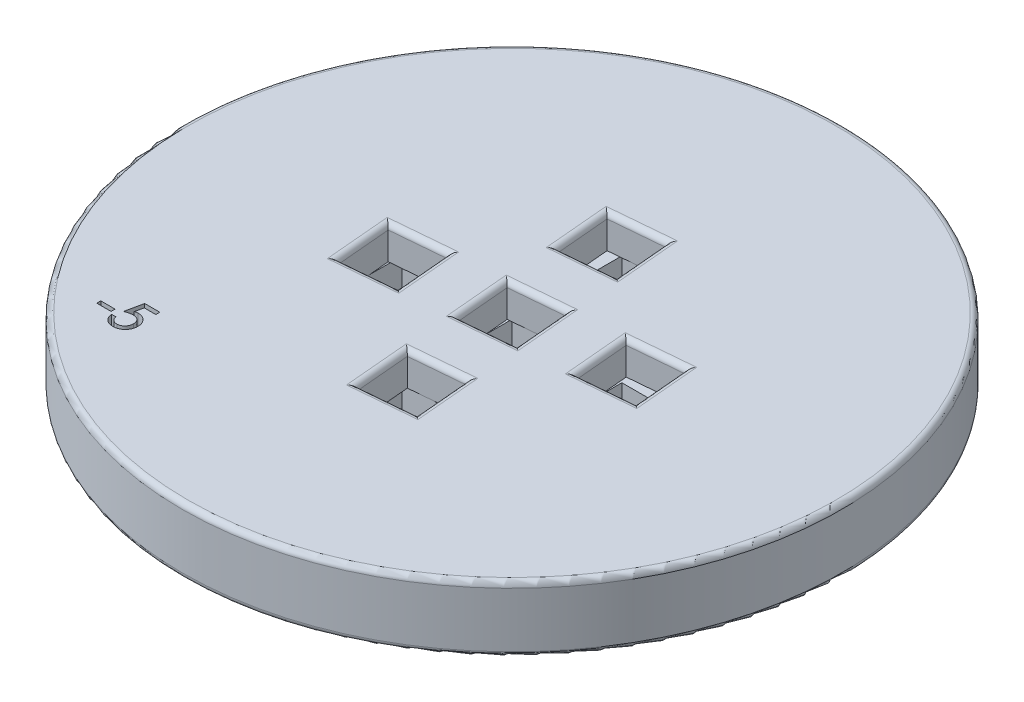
SolidWorks part; units mm, degrees
ref_plane "Front Plane" through (0, 0, 0) normal (0, 0, 1) x (1, 0, 0)
ref_plane "Top Plane" through (0, 0, 0) normal (0, 1, 0) x (1, 0, 0)
ref_plane "Right Plane" through (0, 0, 0) normal (1, 0, 0) x (0, 0, -1)
sketch "Sketch1" plane through (0, 0, 0) normal (0, 1, 0) x (1, 0, 0)
  circle A0 centre (0, 0) radius 30
extrude "Boss-Extrude1" add sketch "Sketch1" along normal blind 6
sketch "Sketch2" plane through (0, 6, 0) normal (0, 1, 0) x (1, 0, 0)
  line L0 (0, 0) -> (0, -10) construction
  line L1 (0, 0) -> (10, 0) construction
  line L2 (0, 0) -> (-10, 0) construction
  line L3 (0, 0) -> (0, 10) construction
  line L5 (-2.5, -7.5) -> (2.5, -7.5)
  line L6 (-2.5, -7.5) -> (-2.5, -12.5)
  line L7 (-2.5, -12.5) -> (2.5, -12.5)
  line L8 (2.5, -7.5) -> (2.5, -12.5)
  line L9 (-2.5, -7.5) -> (2.5, -12.5) construction
  line L10 (-2.5, -12.5) -> (2.5, -7.5) construction
  line L11 (-7.5, -2.5) -> (-12.5, -2.5)
  line L12 (-7.5, -2.5) -> (-7.5, 2.5)
  line L13 (-7.5, 2.5) -> (-12.5, 2.5)
  line L14 (-12.5, -2.5) -> (-12.5, 2.5)
  line L15 (-7.5, -2.5) -> (-12.5, 2.5) construction
  line L16 (-7.5, 2.5) -> (-12.5, -2.5) construction
  line L17 (2.5, -2.5) -> (-2.5, -2.5)
  line L18 (2.5, -2.5) -> (2.5, 2.5)
  line L19 (2.5, 2.5) -> (-2.5, 2.5)
  line L20 (-2.5, -2.5) -> (-2.5, 2.5)
  line L21 (2.5, -2.5) -> (-2.5, 2.5) construction
  line L22 (2.5, 2.5) -> (-2.5, -2.5) construction
  line L23 (-2.5, 12.5) -> (2.5, 12.5)
  line L24 (-2.5, 12.5) -> (-2.5, 7.5)
  line L25 (-2.5, 7.5) -> (2.5, 7.5)
  line L26 (2.5, 12.5) -> (2.5, 7.5)
  line L27 (-2.5, 12.5) -> (2.5, 7.5) construction
  line L28 (-2.5, 7.5) -> (2.5, 12.5) construction
  line L29 (12.5, -2.5) -> (7.5, -2.5)
  line L30 (12.5, -2.5) -> (12.5, 2.5)
  line L31 (12.5, 2.5) -> (7.5, 2.5)
  line L32 (7.5, -2.5) -> (7.5, 2.5)
  line L33 (12.5, -2.5) -> (7.5, 2.5) construction
  line L34 (12.5, 2.5) -> (7.5, -2.5) construction
  dimension "D1" = 5
  dimension "D2" = 10
  dimension "D3" = 5
  dimension "D4" = 5
  dimension "D5" = 5
  dimension "D6" = 5
  dimension "D7" = 5
  dimension "D8" = 5
sketch "Sketch3" plane through (0, 6, 0) normal (0, 1, 0) x (1, 0, 0)
sketch "Sketch4" plane through (0, 0, 0) normal (0, -1, 0) x (-1, 0, 0)
  line L0 (0, 0) -> (-10, 0) construction
  line L1 (0, 0) -> (0, -10) construction
  line L2 (0, 0) -> (0, 10) construction
  line L3 (0, 0) -> (10, 0) construction
  line L5 (-2.5, 2.5) -> (2.5, 2.5)
  line L6 (-2.5, 2.5) -> (-2.5, -2.5)
  line L7 (-2.5, -2.5) -> (2.5, -2.5)
  line L8 (2.5, 2.5) -> (2.5, -2.5)
  line L9 (-2.5, 2.5) -> (2.5, -2.5) construction
  line L10 (-2.5, -2.5) -> (2.5, 2.5) construction
  line L11 (-2.5, -7.5) -> (2.5, -7.5)
  line L12 (-2.5, -7.5) -> (-2.5, -12.5)
  line L13 (-2.5, -12.5) -> (2.5, -12.5)
  line L14 (2.5, -7.5) -> (2.5, -12.5)
  line L15 (-2.5, -7.5) -> (2.5, -12.5) construction
  line L16 (-2.5, -12.5) -> (2.5, -7.5) construction
  line L17 (7.5, 2.5) -> (12.5, 2.5)
  line L18 (7.5, 2.5) -> (7.5, -2.5)
  line L19 (7.5, -2.5) -> (12.5, -2.5)
  line L20 (12.5, 2.5) -> (12.5, -2.5)
  line L21 (7.5, 2.5) -> (12.5, -2.5) construction
  line L22 (7.5, -2.5) -> (12.5, 2.5) construction
  line L23 (-12.5, 2.5) -> (-7.5, 2.5)
  line L24 (-12.5, 2.5) -> (-12.5, -2.5)
  line L25 (-12.5, -2.5) -> (-7.5, -2.5)
  line L26 (-7.5, 2.5) -> (-7.5, -2.5)
  line L27 (-12.5, 2.5) -> (-7.5, -2.5) construction
  line L28 (-12.5, -2.5) -> (-7.5, 2.5) construction
  line L29 (2.5, 7.5) -> (-2.5, 7.5)
  line L30 (2.5, 7.5) -> (2.5, 12.5)
  line L31 (2.5, 12.5) -> (-2.5, 12.5)
  line L32 (-2.5, 7.5) -> (-2.5, 12.5)
  line L33 (2.5, 7.5) -> (-2.5, 12.5) construction
  line L34 (2.5, 12.5) -> (-2.5, 7.5) construction
  dimension "D1" = 5
  dimension "D2" = 5
  dimension "D3" = 5
  dimension "D4" = 5
  dimension "D5" = 5
  dimension "D6" = 5
extrude "Cut-Extrude2" cut sketch "Sketch4" against normal blind 3
fillet "Fillet2" radius 0.5 21 edges at (0, 0, 30) (2.5, 0, 0) (0, 0, 2.5) (-2.5, 0, 0) (0, 0, -2.5) (2.5, 0, 10) (0, 0, 12.5) (-2.5, 0, 10) (0, 0, 7.5) (-7.5, 0, 0) (-10, 0, 2.5) (-12.5, 0, 0) (-10, 0, -2.5) (12.5, 0, 0) (10, 0, 2.5) (7.5, 0, 0) (10, 0, -2.5) (-2.5, 0, -10) (0, 0, -12.5) (2.5, 0, -10) (0, 0, -7.5)
fillet "Fillet3" radius 0.5 1 edges at (0, 6, 30)
sketch "Sketch5" plane through (0, 6, 0) normal (0, 1, 0) x (1, 0, 0)
sketch "Sketch6" plane through (0, 6, 0) normal (0, 1, 0) x (1, 0, 0)
  line L0 (0, -30) -> (0, 30) construction
  line L1 (0, 0) -> (-2.6147, 29.8858) construction
  line L2 (-2.2726, -2.7084) -> (2.7084, -2.2726)
  line L3 (-2.2726, -2.7084) -> (-2.7084, 2.2726)
  line L4 (2.7084, -2.2726) -> (2.2726, 2.7084)
  line L5 (-2.7084, 2.2726) -> (2.2726, 2.7084)
  line L6 (-2.2726, -2.7084) -> (2.2726, 2.7084) construction
  line L7 (2.7084, -2.2726) -> (-2.7084, 2.2726) construction
  line L8 (-3.1442, 7.2536) -> (1.8368, 7.6893)
  line L9 (-3.1442, 7.2536) -> (-3.5799, 12.2345)
  line L10 (1.8368, 7.6893) -> (1.401, 12.6703)
  line L11 (-3.5799, 12.2345) -> (1.401, 12.6703)
  line L12 (-3.1442, 7.2536) -> (1.401, 12.6703) construction
  line L13 (1.8368, 7.6893) -> (-3.5799, 12.2345) construction
  line L14 (0, 0) -> (2.5711, -29.3877) construction
  line L15 (3.5799, -12.2345) -> (-1.401, -12.6703)
  line L16 (3.5799, -12.2345) -> (3.1442, -7.2536)
  line L17 (-1.401, -12.6703) -> (-1.8368, -7.6893)
  line L18 (3.1442, -7.2536) -> (-1.8368, -7.6893)
  line L19 (3.5799, -12.2345) -> (-1.8368, -7.6893) construction
  line L20 (-1.401, -12.6703) -> (3.1442, -7.2536) construction
  line L21 (0, 0) -> (-29.3877, -2.5711) construction
  line L22 (0, 0) -> (29.3877, 2.5711) construction
  line L23 (12.6703, -1.401) -> (7.6893, -1.8368)
  line L24 (12.6703, -1.401) -> (12.2345, 3.5799)
  line L25 (7.6893, -1.8368) -> (7.2536, 3.1442)
  line L26 (12.2345, 3.5799) -> (7.2536, 3.1442)
  line L27 (12.6703, -1.401) -> (7.2536, 3.1442) construction
  line L28 (7.6893, -1.8368) -> (12.2345, 3.5799) construction
  line L29 (-12.2345, -3.5799) -> (-7.2536, -3.1442)
  line L30 (-12.2345, -3.5799) -> (-12.6703, 1.401)
  line L31 (-7.2536, -3.1442) -> (-7.6893, 1.8368)
  line L32 (-12.6703, 1.401) -> (-7.6893, 1.8368)
  line L33 (-12.2345, -3.5799) -> (-7.6893, 1.8368) construction
  line L34 (-7.2536, -3.1442) -> (-12.6703, 1.401) construction
  line L35 (-19.7925, -19.1465) -> (-12.6703, -19.1465) construction
  circle A0 centre (0, 0) radius 30 construction
  circle A1 centre (0, 0) radius 29.5 construction
  text T0 "<b>-5</b>"
  point P8 (-0.8716, 9.9619)
  point P21 (0.8716, -9.9619)
  point P23 (9.9619, 0.8716)
  point P28 (-9.9619, -0.8716)
  dimension "D1" = 5
  dimension "D2" = 5
  dimension "D3" = 5
  dimension "D4" = 10
  dimension "D5" = 5
  dimension "D6" = 5
  dimension "D7" = 5
  dimension "D8" = 5
  dimension "D9" = 5
  dimension "D10" = 90
  dimension "D11" = 90
  dimension "D12" = 10
  dimension "D13" = 5
  dimension "D14" = 5
  dimension "D15" = 180
  dimension "D16" = 5
  dimension "D17" = 5
  dimension "D18" = 180
  dimension "D19" = 10
  dimension "D20" = 10
extrude "Cut-Extrude3" cut sketch "Sketch6" against normal blind 3
fillet "Fillet5" radius 0.5 20 edges at (10.1798, 6, 1.6189) (12.4524, 6, -1.0894) (7.4715, 6, -0.6537) (9.7441, 6, -3.362) (-0.6537, 6, -7.4715) (1.6189, 6, -10.1798) (-1.0894, 6, -12.4524) (-3.362, 6, -9.7441) (0.2179, 6, 2.4905) (-2.4905, 6, 0.2179) (-0.2179, 6, -2.4905) (2.4905, 6, -0.2179) (1.0894, 6, 12.4524) (3.362, 6, 9.7441) (0.6537, 6, 7.4715) (-1.6189, 6, 10.1798) (-9.7441, 6, 3.362) (-7.4715, 6, 0.6537) (-10.1798, 6, -1.6189) (-12.4524, 6, 1.0894)
